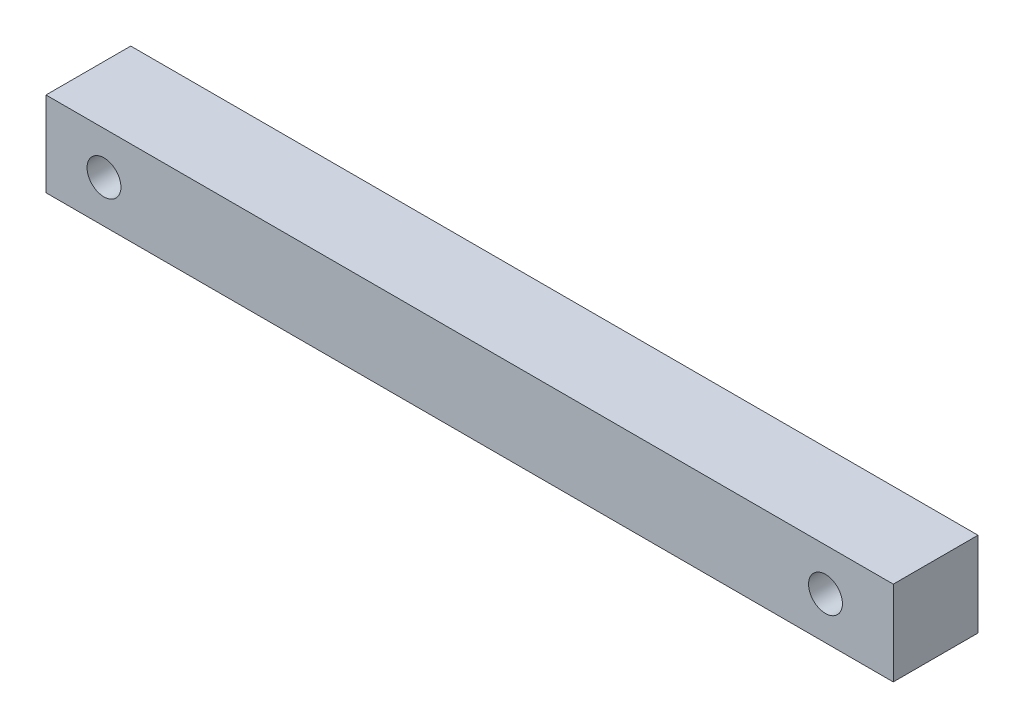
SolidWorks part; units mm, degrees
ref_plane "Front Plane" through (0, 0, 0) normal (0, 0, 1) x (1, 0, 0)
ref_plane "Top Plane" through (0, 0, 0) normal (0, 1, 0) x (1, 0, 0)
ref_plane "Right Plane" through (0, 0, 0) normal (1, 0, 0) x (0, 0, -1)
sketch "Sketch1" plane through (0, 0, 0) normal (0, 0, 1) x (1, 0, 0)
  line L1 (-25, 2.5) -> (25, 2.5)
  line L2 (-25, 2.5) -> (-25, -2.5)
  line L3 (-25, -2.5) -> (25, -2.5)
  line L4 (25, 2.5) -> (25, -2.5)
extrude "Boss-Extrude1" add sketch "Sketch1" along normal blind 5
sketch "Sketch2" plane through (0, 0, 5) normal (0, 0, 1) x (1, 0, 0)
  line L0 (25, -2.5) -> (25, 2.5) construction
  circle A0 centre (-21.578, 0) radius 1
  circle A1 centre (21, 0) radius 1
  point P4 (25, 0)
  dimension "D1" = 42.578
  dimension "D2" = 4
extrude "Cut-Extrude1" cut sketch "Sketch2" against normal blind 5
